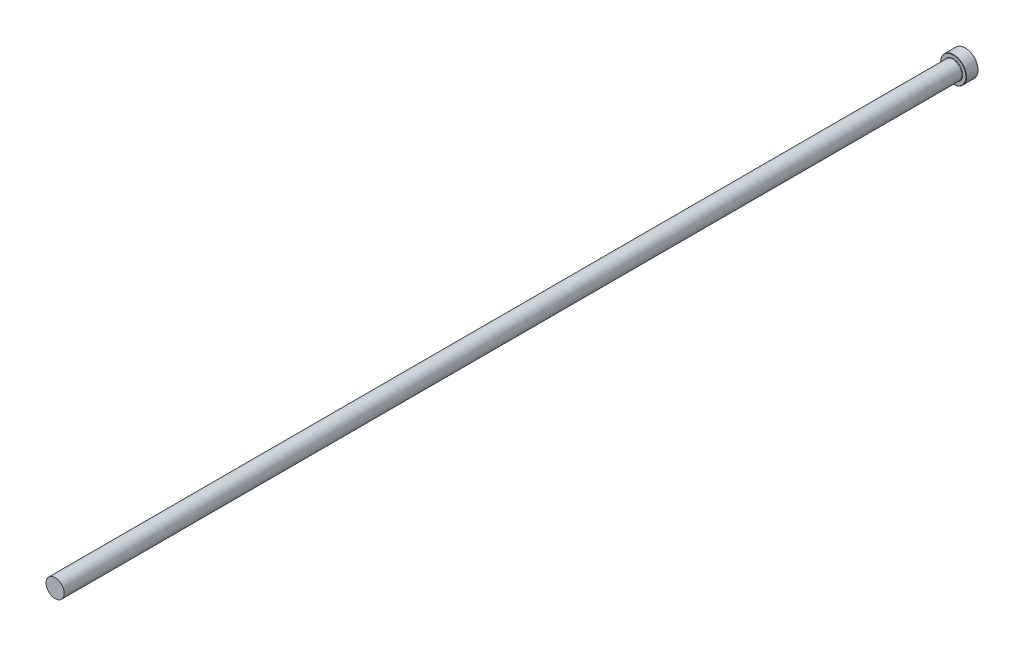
SolidWorks part; units mm, degrees
ref_plane "Front Plane" through (0, 0, 0) normal (0, 0, 1) x (1, 0, 0)
ref_plane "Top Plane" through (0, 0, 0) normal (0, 1, 0) x (1, 0, 0)
ref_plane "Right Plane" through (0, 0, 0) normal (1, 0, 0) x (0, 0, -1)
sketch "Sketch1" plane through (0, 0, 0) normal (1, 0, 0) x (0, 0, -1)
  line L0 (0, 0) -> (0, 8.5)
  line L1 (0, 9.35) -> (0, -9.35) construction
  line L2 (0, 8.5) -> (-8, 8.5)
  line L3 (-8, 8.5) -> (-8, 6.3)
  line L4 (-8.3, 6) -> (-600, 6)
  line L5 (-600, 6) -> (-600, 0)
  line L6 (9.35, 0) -> (-9.35, 0) construction
  line L7 (-600, 0) -> (0, 0)
  line L8 (-109.0506, 0) -> (16.9928, 0) construction
  arc A0 (-8, 6.3) -> (-8.3, 6) centre (-8.3, 6.3) cw
  dimension "D1" = 0.3
  dimension "D2" = 17
  dimension "D3" = 12
  dimension "D4" = 600
  dimension "D5" = 8
revolve "Revolve1" add sketch "Sketch1" angle 360 about L8
chamfer "Chamfer1" distance 0.2 angle 45 2 edges at (8.5, 0, 0) (8.5, 0, 8)
